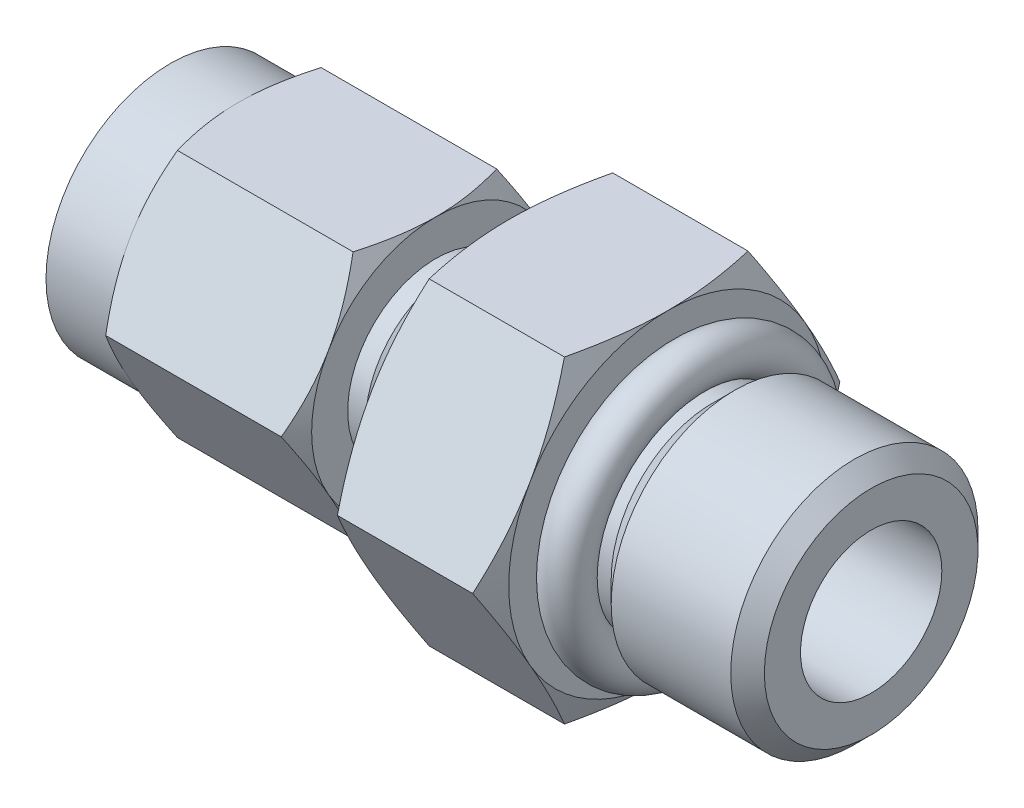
SolidWorks part; units mm, degrees
ref_plane "Front Plane" through (0, 0, 0) normal (0, 0, 1) x (1, 0, 0)
ref_plane "Top Plane" through (0, 0, 0) normal (0, 1, 0) x (1, 0, 0)
ref_plane "Right Plane" through (0, 0, 0) normal (1, 0, 0) x (0, 0, -1)
imported_body "Imported1"
hole_wizard "1/4-28 Tapped Hole1" positions "Sketch3" profile "Sketch2" tap size "1/4-28" standard "ANSI Inch"
sketch "Sketch3" plane through (0, 0, 0) normal (1, 0, 0) x (0, 0, -1)
  point P0 (0, 0)
sketch "Sketch2" plane through (0, 0, 0) normal (0, 1, 0) x (0, 0, -1)
  line L0 (0, 0) -> (0, 8.89)
  line L1 (0, 8.89) -> (2.7051, 8.89)
  line L2 (2.7051, 8.89) -> (2.7051, 7.112)
  line L3 (2.7051, 7.112) -> (3.175, 7.112)
  line L4 (3.175, 7.112) -> (3.175, 0)
  line L5 (3.175, 0) -> (0, 0)
  line L10 (0, 8.89) -> (-2.7051, 8.89) construction
  line L11 (0, -6.35) -> (0, 107.95) construction
  dimension "Tap Drill Dia." = 5.4102
  dimension "Tap Drill Depth" = 8.89
  dimension "Thread Major Dia." = 6.35
  dimension "Thread Depth" = 7.112
  dimension "Drill Angle" = 180
sketch "Sketch1" plane through (0, 0, 0) normal (1, 0, 0) x (0, 0, -1)
  line L0 (0, 0) -> (0, 10)
  line L1 (0, 0) -> (-10, 0)
  arc A0 (-10, 0) -> (0, 10) centre (0, 0) ccw
  dimension "D1" = 20
extrude "Cut-Extrude1" [suppressed] cut sketch "Sketch1" against normal through all
